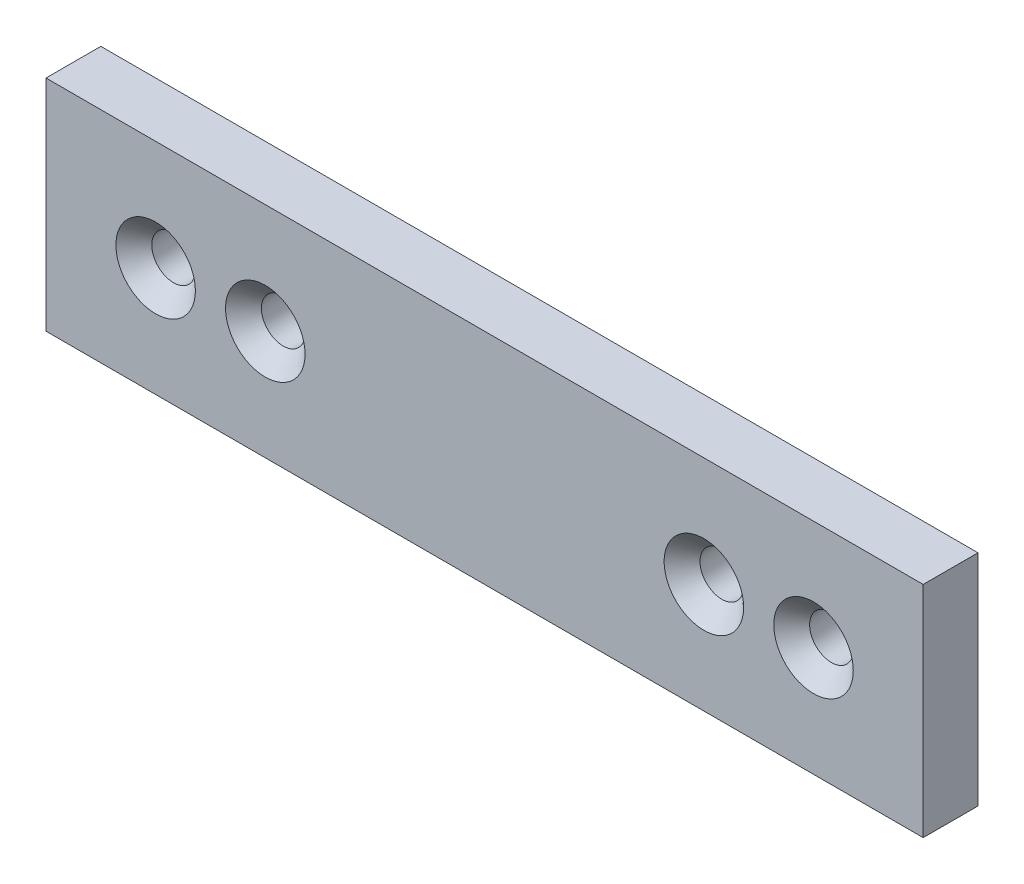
SolidWorks part; units mm, degrees
ref_plane "Front Plane" through (0, 0, 0) normal (0, 0, 1) x (1, 0, 0)
ref_plane "Top Plane" through (0, 0, 0) normal (0, 1, 0) x (1, 0, 0)
ref_plane "Right Plane" through (0, 0, 0) normal (1, 0, 0) x (0, 0, -1)
sketch "Sketch1" plane through (0, 0, 0) normal (0, 0, 1) x (1, 0, 0)
  line L1 (-73.3681, 17.4271) -> (28.2319, 17.4271)
  line L2 (-73.3681, 17.4271) -> (-73.3681, -7.9729)
  line L3 (-73.3681, -7.9729) -> (28.2319, -7.9729)
  line L4 (28.2319, 17.4271) -> (28.2319, -7.9729)
  dimension "D1" = 101.6
  dimension "D2" = 25.4
extrude "Boss-Extrude1" add sketch "Sketch1" along normal blind 6.35
hole_wizard "#8 (0.199) Diameter Hole1" positions "Sketch2" profile "Sketch3" hole size "#8" standard "ANSI Inch"
sketch "Sketch2" plane through (0, 0, 6.35) normal (0, 0, 1) x (1, 0, 0)
  line L0 (-73.3681, 17.4271) -> (-73.3681, -7.9729) construction
  line L1 (28.2319, 17.4271) -> (-73.3681, 17.4271) construction
  line L2 (28.2319, -7.9729) -> (28.2319, 17.4271) construction
  point P0 (-60.6681, 4.7271)
  point P2 (-47.9681, 4.7271)
  point P4 (2.8319, 4.7271)
  point P6 (15.5319, 4.7271)
  dimension "D1" = 12.7
  dimension "D2" = 12.7
  dimension "D3" = 12.7
  dimension "D4" = 12.7
  dimension "D5" = 12.7
  dimension "D6" = 25.4
  dimension "D7" = 12.7
  dimension "D8" = 25.4
sketch "Sketch3" plane through (-60.6681, 4.7271, 6.35) normal (1, 0, 0) x (0, -1, 0)
  line L0 (0, 0) -> (0, 6.35)
  line L1 (0, 6.35) -> (2.5273, 6.35)
  line L2 (2.5273, 6.35) -> (2.5273, 2.0764)
  line L3 (2.5273, 2.0764) -> (4.6037, 0)
  line L5 (4.6037, 0) -> (0, 0)
  line L6 (-2.5273, 2.0764) -> (-4.6037, 0) construction
  line L11 (0, -6.35) -> (0, 107.95) construction
  dimension "Thru Hole Dia." = 5.0546
  dimension "Thru Hole Depth" = 6.35
  dimension "Near C'Sink Dia." = 9.2075
  dimension "Near C'Sink Angle" = 90
